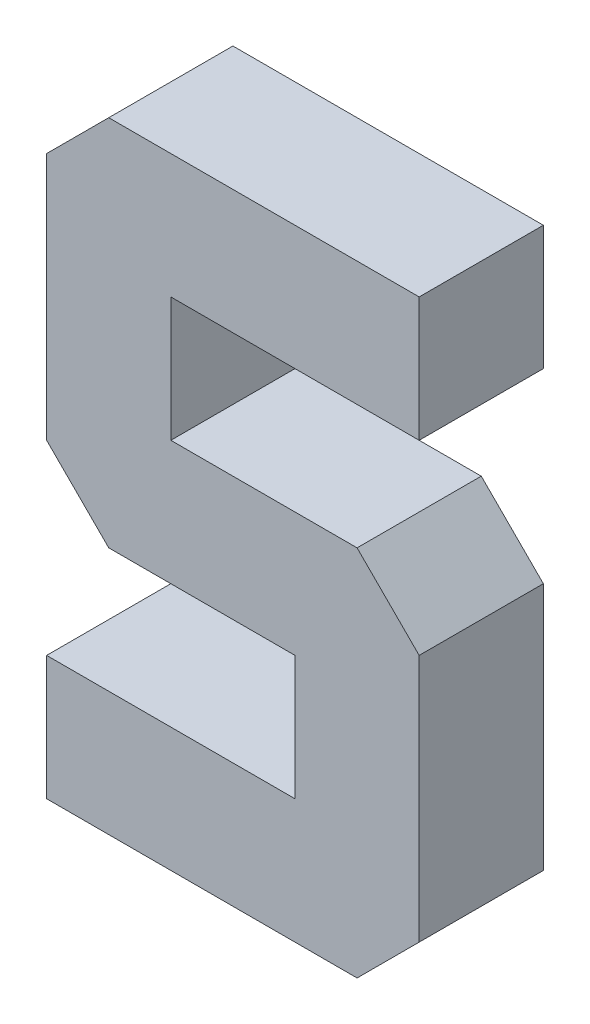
SolidWorks part; units mm, degrees
ref_plane "Plan de face" through (0, 0, 0) normal (0, 0, 1) x (1, 0, 0)
ref_plane "Plan de dessus" through (0, 0, 0) normal (0, 1, 0) x (1, 0, 0)
ref_plane "Plan de droite" through (0, 0, 0) normal (1, 0, 0) x (0, 0, -1)
sketch "Esquisse1" plane through (0, 0, 0) normal (0, 0, 1) x (1, 0, 0)
  line L0 (30, 40) -> (30, 50)
  line L1 (0, 0) -> (30, 0)
  line L2 (0, 0) -> (0, 10)
  line L3 (0, 50) -> (30, 50)
  line L4 (30, 0) -> (30, 30)
  line L5 (30, 40) -> (10, 40)
  line L6 (0, 20) -> (0, 50)
  line L7 (30, 30) -> (10, 30)
  line L8 (10, 40) -> (10, 30)
  line L9 (0, 20) -> (20, 20)
  line L11 (0, 10) -> (20, 10)
  line L12 (20, 20) -> (20, 10)
  dimension "D1" = 30
  dimension "D2" = 50
  dimension "D3" = 10
  dimension "D4" = 10
  dimension "D5" = 20
  dimension "D6" = 20
  dimension "D7" = 10
  dimension "D8" = 10
extrude "Boss.-Extru.1" add sketch "Esquisse1" along normal blind 10
chamfer "Chanfrein2" distance 5 angle 45 4 edges at (30, 0, 5) (30, 30, 5) (0, 20, 5) (0, 50, 5)
